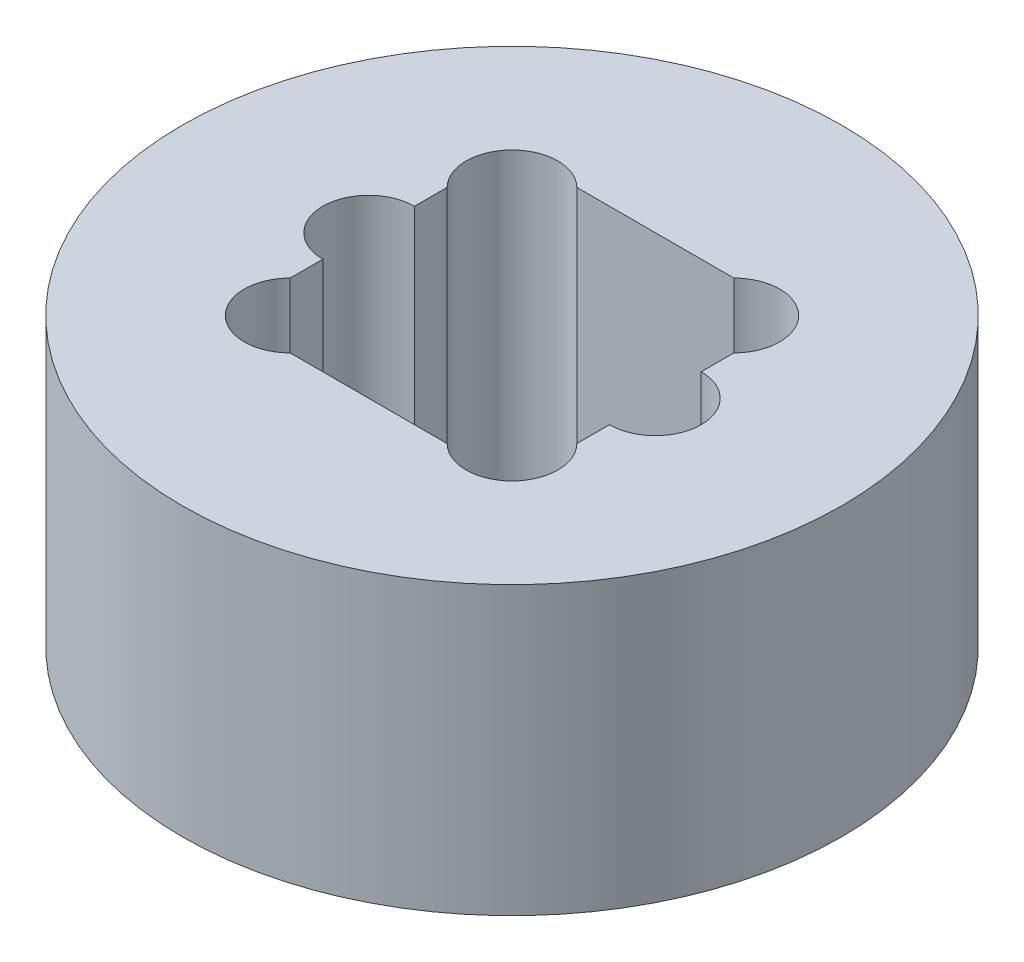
SolidWorks part; units mm, degrees
ref_plane "Plan de face" through (0, 0, 0) normal (0, 0, 1) x (1, 0, 0)
ref_plane "Plan de dessus" through (0, 0, 0) normal (0, 1, 0) x (1, 0, 0)
ref_plane "Plan de droite" through (0, 0, 0) normal (1, 0, 0) x (0, 0, -1)
sketch "Esquisse1" plane through (0, 0, 0) normal (0, 1, 0) x (1, 0, 0)
  circle A0 centre (0, 0) radius 11.5
extrude "Boss.-Extru.1" add sketch "Esquisse1" along normal blind 10
sketch "Esquisse3" plane through (0, 10, 0) normal (0, 1, 0) x (1, 0, 0)
  line L0 (0, -5) -> (0, 9.0771) construction
  line L1 (-2.7373, -5) -> (2.7373, -5)
  line L2 (-5, -2.7373) -> (-5, 2.7373)
  line L3 (-2.7373, 5) -> (2.7373, 5)
  line L4 (5, -2.7373) -> (5, 2.7373)
  line L5 (-5, -5) -> (5, 5) construction
  line L6 (-5, 5) -> (5, -5) construction
  line L7 (5.0751, 0) -> (-10.5125, 0) construction
  arc A0 (-2.7373, -5) -> (-5, -2.7373) centre (-3.8686, -3.8686) cw
  arc A1 (2.7373, -5) -> (5, -2.7373) centre (3.8686, -3.8686) ccw
  arc A2 (2.7373, 5) -> (5, 2.7373) centre (3.8686, 3.8686) cw
  arc A3 (-2.7373, 5) -> (-5, 2.7373) centre (-3.8686, 3.8686) ccw
  point P0 (0, 0)
  point P8 (-3.8686, -3.8686)
  dimension "D3" = 1.6
  dimension "D1" = 10
  dimension "D2" = 10
extrude "Enlèv. mat.-Extru.1" cut sketch "Esquisse3" against normal through all
sketch "Esquisse4" plane through (0, 0, 0) normal (0, -1, 0) x (-1, 0, 0)
  line L2 (0, -5.0751) -> (0, 10.4254) construction
  circle A0 centre (5, 0) radius 1.6
  circle A1 centre (-5, 0) radius 1.6
  dimension "D1" = 5
extrude "Enlèv. mat.-Extru.2" cut sketch "Esquisse4" against normal blind 10
